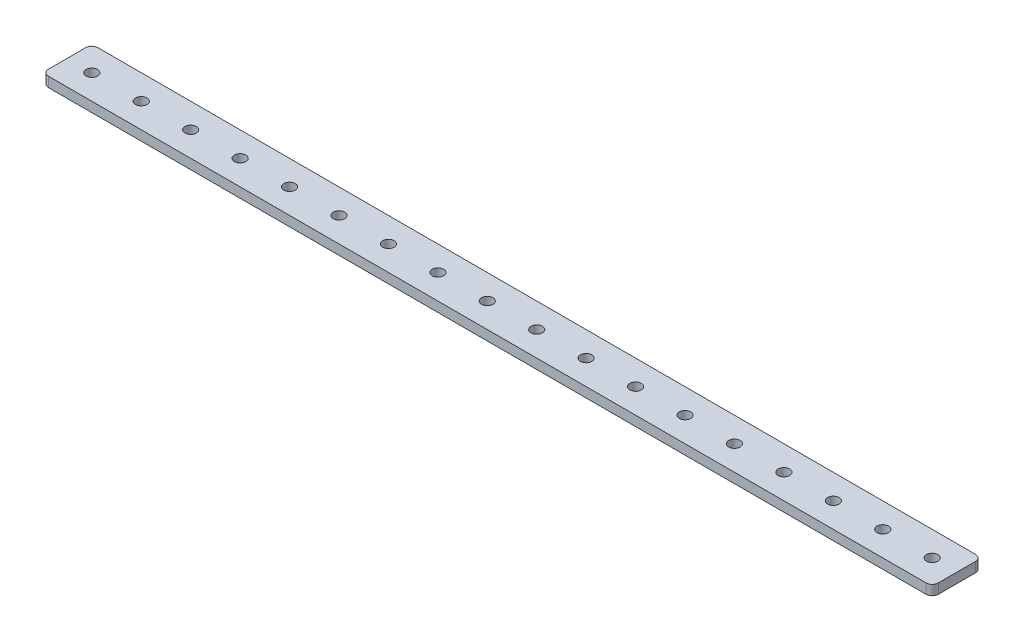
SolidWorks part; units mm, degrees
ref_plane "Front Plane" through (0, 0, 0) normal (0, 0, 1) x (1, 0, 0)
ref_plane "Top Plane" through (0, 0, 0) normal (0, 1, 0) x (1, 0, 0)
ref_plane "Right Plane" through (0, 0, 0) normal (1, 0, 0) x (0, 0, -1)
sketch "Sketch1" plane through (0, 0, 0) normal (0, 1, 0) x (1, 0, 0)
  line L1 (0, 0) -> (288, 0)
  line L2 (0, 0) -> (0, 16)
  line L3 (0, 16) -> (288, 16)
  line L4 (288, 0) -> (288, 16)
  dimension "D1" = 288
  dimension "D2" = 16
extrude "Extrude1" add sketch "Sketch1" along normal blind 3.2
sketch "Sketch2" plane through (0, 3.2, 0) normal (0, 1, 0) x (1, 0, 0)
  line L0 (0, 16) -> (0, 0) construction
  line L1 (288, 8) -> (-23.3484, 8) construction
  line L2 (288, 0) -> (288, 16) construction
  line L3 (-23.3484, 8) -> (329.3474, 8) construction
  line L4 (0, 0) -> (288, 0) construction
  circle A0 centre (8, 8) radius 1.85
  circle A1 centre (24, 8) radius 1.85
  circle A2 centre (40, 8) radius 1.85
  circle A3 centre (56, 8) radius 1.85
  circle A4 centre (72, 8) radius 1.85
  circle A5 centre (88, 8) radius 1.85
  circle A6 centre (104, 8) radius 1.85
  circle A7 centre (120, 8) radius 1.85
  circle A8 centre (136, 8) radius 1.85
  circle A9 centre (152, 8) radius 1.85
  circle A10 centre (168, 8) radius 1.85
  circle A11 centre (184, 8) radius 1.85
  circle A12 centre (200, 8) radius 1.85
  circle A13 centre (216, 8) radius 1.85
  circle A14 centre (232, 8) radius 1.85
  circle A15 centre (248, 8) radius 1.85
  circle A16 centre (264, 8) radius 1.85
  circle A17 centre (280, 8) radius 1.85
  dimension "D1" = 3.7
  dimension "D2" = 8
  dimension "D3" = 8
  dimension "D4" = 16
  dimension "D5" = 16
  dimension "D6" = 16
  dimension "D7" = 16
  dimension "D8" = 16
  dimension "D9" = 16
  dimension "D10" = 16
  dimension "D11" = 16
  dimension "D12" = 16
  dimension "D13" = 16
  dimension "D14" = 16
  dimension "D15" = 16
  dimension "D16" = 16
  dimension "D17" = 16
  dimension "D18" = 16
  dimension "D19" = 16
  dimension "D20" = 16
extrude "Cut-Extrude1" cut sketch "Sketch2" against normal through all
fillet "Fillet1" radius 2 1 edges at (288, 1.6, 0)
fillet "Fillet2" radius 2 1 edges at (288, 1.6, -16)
fillet "Fillet3" radius 2 1 edges at (0, 1.6, -16)
fillet "Fillet4" radius 2 1 edges at (0, 1.6, 0)
